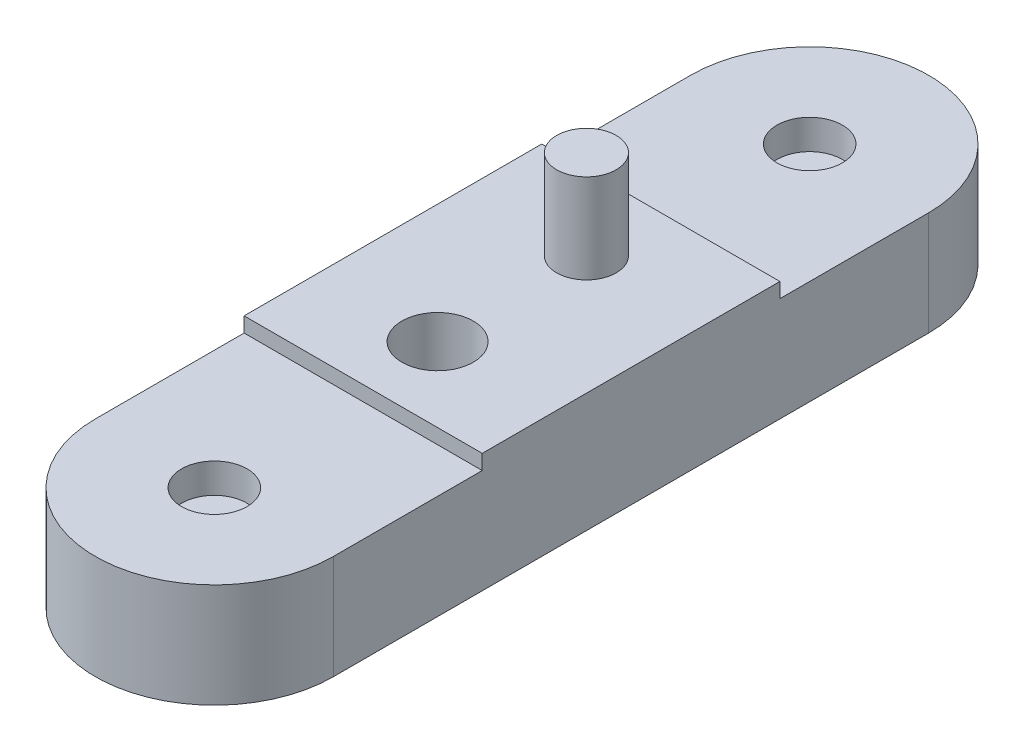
SolidWorks part; units mm, degrees
ref_plane "Front" through (0, 0, 0) normal (0, 0, 1) x (1, 0, 0)
ref_plane "Top" through (0, 0, 0) normal (0, 1, 0) x (1, 0, 0)
ref_plane "Right" through (0, 0, 0) normal (1, 0, 0) x (0, 0, -1)
sketch "Sketch1" plane through (0, 0, 0) normal (0, 1, 0) x (1, 0, 0)
  line L0 (0, 1) -> (-8.1896, 1) construction
  line L1 (0, 4) -> (-8.1896, 4) construction
  line L2 (-4, -10) -> (4, -10)
  line L3 (-4, 0) -> (4, 0) construction
  line L4 (-4, 0) -> (-4, -10)
  line L6 (4, 0) -> (4, -10)
  circle A0 centre (0, 0) radius 1 construction
  arc A1 (4, 0) -> (-4, 0) centre (0, 0) ccw
  dimension "D1" = 2
  dimension "D2" = 3
  dimension "D3" = 10
extrude "Boss-Extrude1" add sketch "Sketch1" along normal blind 4
sketch "Sketch2" plane through (0, 4, 0) normal (0, 1, 0) x (1, 0, 0)
  line L0 (0, 0) -> (-11.0692, 0) construction
  line L1 (-4, -5) -> (4, -5)
  line L2 (-4, 0) -> (-4, -10) construction
  line L3 (4, -10) -> (4, 0) construction
  line L4 (-4, 0) -> (-4, -5)
  line L5 (4, 0) -> (4, -5)
  line L6 (0, -4) -> (-8.4344, -4) construction
  arc A0 (4, 0) -> (-4, 0) centre (0, 0) ccw construction
  arc A1 (4, 0) -> (-4, 0) centre (0, 0) ccw
  circle A2 centre (0, 0) radius 4 construction
  dimension "D1" = 1
extrude "Cut-Extrude1" cut sketch "Sketch2" against normal blind 0.5
sketch "Sketch3" plane through (0, 3.5, 0) normal (0, 1, 0) x (1, 0, 0)
  circle A0 centre (0, 0) radius 1.1
  dimension "D1" = 2.2
extrude "Cut-Extrude2" cut sketch "Sketch3" against normal blind 1
mirror "Mirror1" about plane through (-4, 4, 10) normal (0, 0, -1)
sketch "Sketch4" plane through (0, 4, 0) normal (0, 1, 0) x (1, 0, 0)
  line L0 (0, -5) -> (0, -15) construction
  line L1 (-4, -5) -> (4, -5) construction
  line L2 (-4, -15) -> (4, -15) construction
  line L3 (0, -10) -> (-6.044, -10) construction
  circle A0 centre (0, -7.5) radius 1
  dimension "D2" = 2
  dimension "D1" = 2.5
extrude "Boss-Extrude2" add sketch "Sketch4" along normal blind 3
sketch "Sketch5" plane through (0, 4, 0) normal (0, 1, 0) x (1, 0, 0)
  line L0 (0, -5) -> (0, -15) construction
  line L1 (-4, -5) -> (4, -5) construction
  line L2 (-4, -15) -> (4, -15) construction
  line L3 (0, -10) -> (-7.1463, -10) construction
  circle A0 centre (0, -12.5) radius 1.2
  dimension "D2" = 2.4
  dimension "D1" = 2.5
extrude "Cut-Extrude3" cut sketch "Sketch5" against normal blind 4
